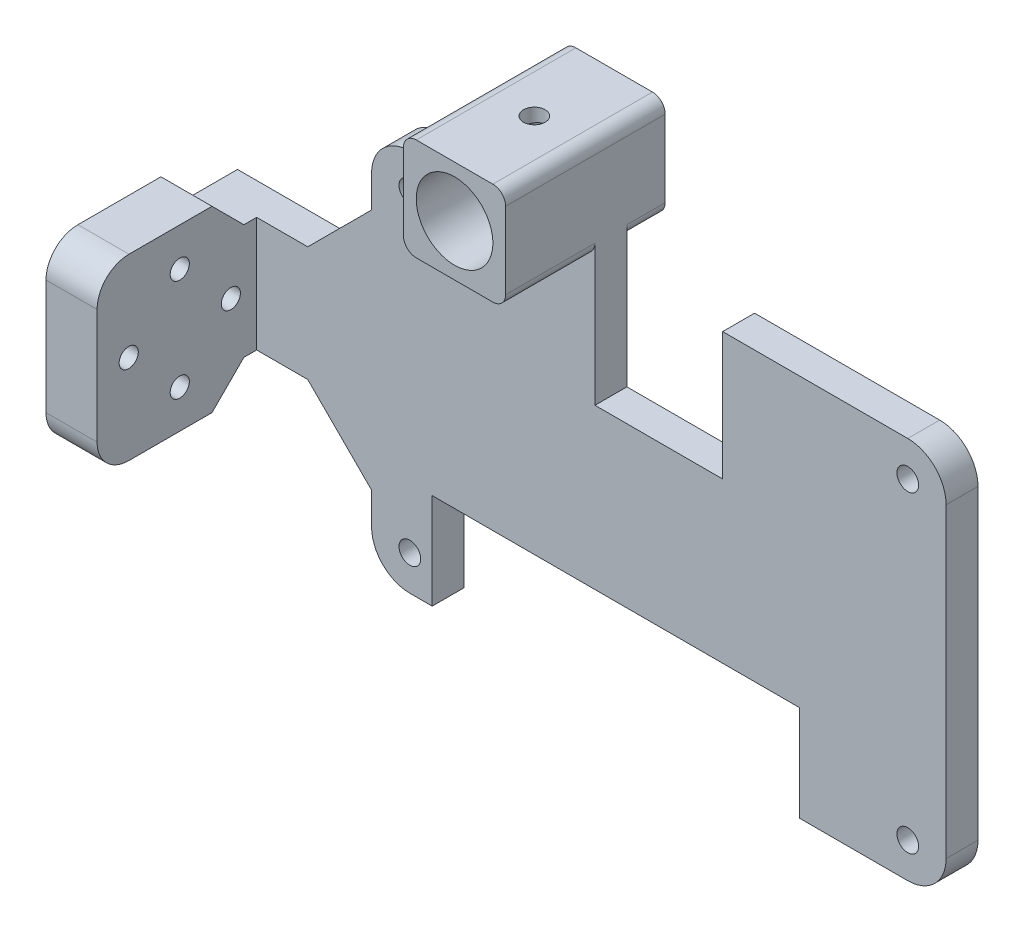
SolidWorks part; units mm, degrees
ref_plane "前视基准面" through (0, 0, 0) normal (0, 0, 1) x (1, 0, 0)
ref_plane "上视基准面" through (0, 0, 0) normal (0, 1, 0) x (1, 0, 0)
ref_plane "右视基准面" through (0, 0, 0) normal (1, 0, 0) x (0, 0, -1)
sketch "草图2" plane through (0, 0, 0) normal (0, 0, 1) x (1, 0, 0)
  line L1 (-45, 30) -> (45, 30)
  line L2 (-45, 30) -> (-45, -30)
  line L3 (-45, -30) -> (45, -30)
  line L4 (45, 30) -> (45, -30)
  line L5 (-45, 30) -> (45, -30) construction
  line L6 (-45, -30) -> (45, 30) construction
  point P0 (0, 0)
  dimension "D1" = 90
  dimension "D2" = 60
extrude "凸台-拉伸1" add sketch "草图2" along normal blind 5
sketch "草图3" plane through (0, 0, 0) normal (0, 0, -1) x (-1, 0, 0)
  line L0 (-45, 30) -> (45, -30) construction
  line L1 (-45, -30) -> (45, 30) construction
  line L3 (-39, 24.5) -> (39, 24.5) construction
  line L4 (-39, 24.5) -> (-39, -24.5) construction
  line L5 (-39, -24.5) -> (39, -24.5) construction
  line L6 (39, 24.5) -> (39, -24.5) construction
  line L7 (-39, 24.5) -> (39, -24.5) construction
  line L8 (-39, -24.5) -> (39, 24.5) construction
  circle A0 centre (-39, 24.5) radius 1.7
  circle A1 centre (39, 24.5) radius 1.7
  point P8 (0, 0)
  dimension "D3" = 3.4
  dimension "D4" = 3.4
  dimension "D1" = 78
  dimension "D2" = 49
extrude "切除-拉伸1" cut sketch "草图3" against normal through all
mirror "镜向1" about plane through (0, 0, 0) normal (0, 1, 0) of "切除-拉伸1"
fillet "圆角1" radius 6 4 edges at (-45, 30, 2.5) (-45, -30, 2.5) (45, -30, 2.5) (45, 30, 2.5)
sketch "草图9" plane through (0, 0, 0) normal (0, 0, -1) x (-1, 0, 0)
  line L0 (-39, 30) -> (39, -30) construction
  line L1 (39, 30) -> (-39, -30) construction
  line L2 (0, 35.8176) -> (0, -35.3184) construction
  line L3 (-10, 30) -> (-10, 10)
  line L4 (10, 30) -> (10, 10)
  line L5 (-10, 30) -> (10, 30)
  line L6 (-39, 30) -> (39, 30) construction
  line L7 (-10, 10) -> (10, 10)
  line L8 (10, 35.8176) -> (10, -35.3184) construction
  line L9 (-10, 35.8176) -> (-10, -35.3184) construction
  line L10 (-22, -30) -> (35.5, -30)
  line L11 (-22, -15) -> (35.5, -15)
  line L12 (-22, -15) -> (-22, -30)
  line L13 (35.5, -15) -> (35.5, -30)
  line L14 (-39, -15) -> (39, -15) construction
  line L15 (-39, -30) -> (39, -30) construction
  point P23 (39, -24.5)
  dimension "D5" = 17
  dimension "D6" = 3.5
  dimension "D1" = 10
  dimension "D2" = 10
  dimension "D3" = 20
  dimension "D4" = 15
extrude "切除-拉伸2" cut sketch "草图9" against normal through all
sketch "草图10" plane through (0, 0, 5) normal (0, 0, 1) x (1, 0, 0)
  line L0 (-39, 24.5) -> (39, -24.5) construction
  line L1 (39, 24.5) -> (-39, -24.5) construction
  line L2 (45, 0) -> (-45, 0) construction
  line L3 (45, -24) -> (45, 24) construction
  line L4 (-45, 24) -> (-45, -24) construction
sketch "草图11" plane through (-45, 0, 0) normal (-1, 0, 0) x (0, 0, 1)
  line L0 (5, 0) -> (0, 0) construction
  line L1 (5, 24.5) -> (5, -24.5) construction
  line L2 (5, 9) -> (0, 9)
  line L3 (5, -9) -> (0, -9)
  line L4 (0, 9) -> (0, -9)
  line L5 (5, 9) -> (5, -9)
  dimension "D1" = 9
  dimension "D2" = 9
extrude "凸台-拉伸2" add sketch "草图11" along normal blind 26
sketch "草图12" plane through (0, 0, 0) normal (0, 0, -1) x (-1, 0, 0)
  line L0 (45, 19) -> (55, 9)
  line L1 (45, 24) -> (45, 9) construction
  line L2 (71, 9) -> (45, 9) construction
  line L3 (45, 9) -> (55, 9) construction
  line L4 (45, 9) -> (45, 19) construction
  dimension "D1" = 10
  dimension "D2" = 10
rib "筋1" sketch "草图12" sketch "草图12" thickness 5 extrusion direction parallel to sketch draft on no parameters "D1"=5
mirror "镜向2" about plane through (0, 0, 0) normal (0, 1, 0) of "筋1"
sketch "草图13" plane through (0, 0, 5) normal (0, 0, 1) x (1, 0, 0)
  line L0 (-71, 9) -> (-71, -9)
  line L1 (-63, 9) -> (-63, -9)
  line L2 (-71, 9) -> (-63, 9)
  line L3 (-71, -9) -> (-63, -9)
  dimension "D1" = 8
extrude "凸台-拉伸3" add sketch "草图13" along normal blind 25
sketch "草图18" plane through (0, 9, 0) normal (0, 1, 0) x (1, 0, 0)
  line L0 (-71, -30) -> (-63, -30)
  line L1 (-71, -12) -> (-63, -12)
  line L2 (-71, -12) -> (-71, -30)
  line L3 (-63, -12) -> (-63, -30)
  dimension "D1" = 18
extrude "凸台-拉伸5" add sketch "草图18" along normal blind 5
mirror "镜向5" about plane through (0, 0, 0) normal (0, 1, 0) of "凸台-拉伸5"
sketch "草图19" plane through (-71, 0, 0) normal (-1, 0, 0) x (0, 0, 1)
  line L0 (0, 0) -> (30, 0) construction
  line L1 (30, 14) -> (30, -14) construction
  line L2 (30, 14) -> (12, -9) construction
  line L3 (30, -14) -> (12, 9) construction
  line L4 (19.0435, 0) -> (19.0435, 9.7908) construction
  line L5 (17.0435, 0) -> (17.0435, 9.7908) construction
  circle A0 centre (17.0435, 0) radius 8 construction
  circle A1 centre (17.0435, 8) radius 1.5
  circle A2 centre (25.0435, 0) radius 1.5
  circle A3 centre (17.0435, -8) radius 1.5
  circle A4 centre (9.0435, 0) radius 1.5
  point P13 (19.0435, 0)
  point P23 (17.0435, 0)
  point P27 (17.0435, 0)
  point P30 (17.0435, 0)
  point P33 (17.0435, 0)
  point P34 (17.0435, 0)
  dimension "D1" = 2
  dimension "D2" = 16
  dimension "D3" = 3
  dimension "D4" = 4
extrude "切除-拉伸4" cut sketch "草图19" against normal through all
sketch "草图21" plane through (-71, 0, 0) normal (-1, 0, 0) x (0, 0, 1)
  line L0 (12, 14) -> (7, 9)
  line L1 (12, 9) -> (0, 9) construction
  line L2 (12, 9) -> (12, 14)
  line L3 (7, 9) -> (12, 9)
  dimension "D1" = 5
extrude "凸台-拉伸6" add sketch "草图21" against normal blind 8
mirror "镜向6" about plane through (0, 0, 0) normal (0, 1, 0) of "凸台-拉伸6"
fillet "圆角2" radius 5 2 edges at (-67, -14, 30) (-67, 14, 30)
sketch "草图22" plane through (0, 30, 0) normal (0, 1, 0) x (1, 0, 0)
  line L0 (-39, 0) -> (-39, -5) construction
  line L1 (-10, 6) -> (-26, 6)
  line L2 (-10, 6) -> (-10, -19)
  line L3 (-10, -19) -> (-26, -19)
  line L4 (-26, 6) -> (-26, -19)
  line L5 (-10, 0) -> (-39, 0) construction
  dimension "D1" = 29
  dimension "D2" = 25
  dimension "D3" = 6
  dimension "D4" = 16
extrude "凸台-拉伸9" add sketch "草图22" along normal blind 16
ref_plane "基准面1" through (-18, 0, 0) normal (1, 0, 0) x (0, 0, -1)
sketch "草图26" plane through (-18, 0, 0) normal (1, 0, 0) x (0, 0, -1)
  line L0 (6, 30) -> (0, 24)
  line L1 (0, 41.8) -> (0, -41.8) construction
  line L2 (6, 30) -> (0, 30) construction
  line L3 (0, 30) -> (6, 30) construction
  line L4 (0, 30) -> (0, 24) construction
  dimension "D1" = 6
rib "筋5" sketch "草图26" sketch "草图26" thickness 6 extrusion direction parallel to sketch draft on no parameters "D1"=6
sketch "草图27" plane through (0, 0, -6) normal (0, 0, -1) x (-1, 0, 0)
  line L0 (10, 46) -> (26, 30) construction
  line L1 (26, 46) -> (10, 30) construction
  circle A0 centre (18, 38) radius 6
  dimension "D1" = 12
extrude "切除-拉伸5" cut sketch "草图27" against normal through all
sketch "草图28" plane through (0, 46, 0) normal (0, 1, 0) x (1, 0, 0)
  line L0 (-26, 6) -> (-10, -19) construction
  line L1 (-10, 6) -> (-26, -19) construction
  circle A0 centre (-18, -6.5) radius 1.7
  dimension "D1" = 3.4
fillet "圆角8" radius 2 6 edges at (-26, 30, -3) (-10, 30, -3) (-26, 30, 12) (-10, 30, 12) (-26, 46, 6.5) (-10, 46, 6.5)
extrude "切除-拉伸6" cut sketch "草图28" against normal blind 10
